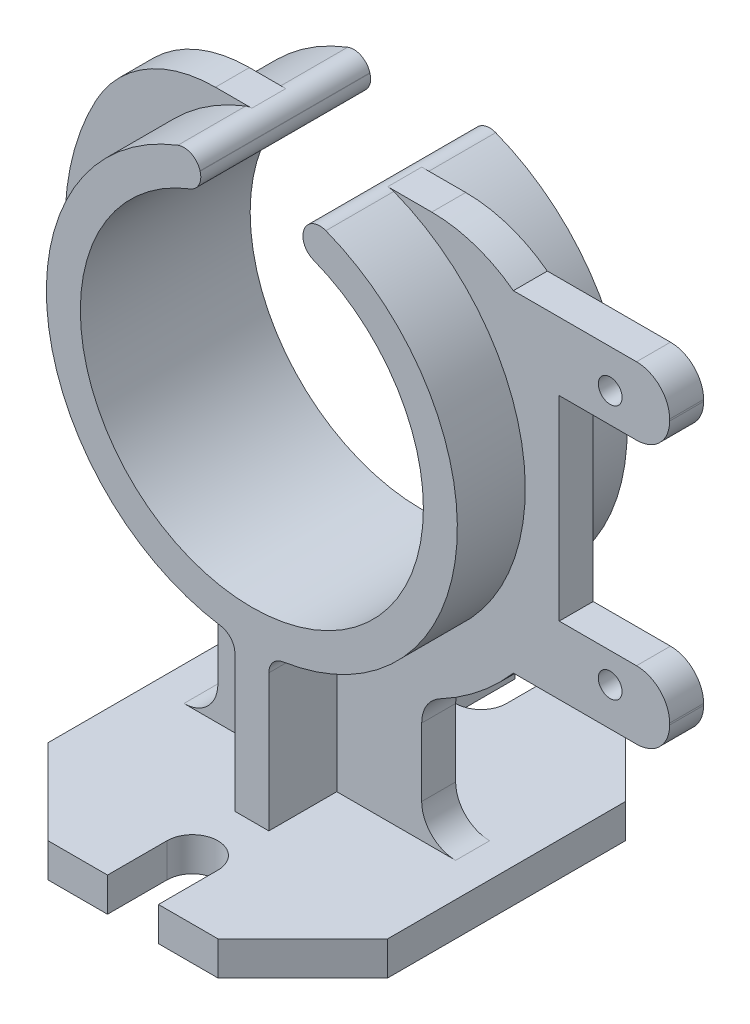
SolidWorks part; units mm, degrees
ref_plane "Plan de face" through (0, 0, 0) normal (0, 0, 1) x (1, 0, 0)
ref_plane "Plan de dessus" through (0, 0, 0) normal (0, 1, 0) x (1, 0, 0)
ref_plane "Plan de droite" through (0, 0, 0) normal (1, 0, 0) x (0, 0, -1)
sketch "Esquisse1" plane through (0, 0, 0) normal (0, 0, 1) x (1, 0, 0)
  line L0 (-30.0885, 0) -> (50.7908, 0) construction
  line L1 (-25.3516, 23) -> (39.2116, 23) construction
  line L2 (0, -16.5794) -> (0, 50.6154) construction
  line L3 (-3.0446, 33.6178) -> (-3.0501, 33.6371)
  line L4 (3.0446, 33.6178) -> (3.0501, 33.6371)
  line L5 (-1, -6.4037) -> (-1, 17.4566) construction
  line L6 (1, 15.0004) -> (1, -2.5439) construction
  line L7 (-1, 10.0621) -> (-1, 0)
  line L8 (-1, 0) -> (1, 0)
  line L9 (1, 0) -> (1, 10.0621)
  arc A0 (-3.6395, 32.4215) -> (3.6395, 32.4215) centre (0, 23) ccw
  arc A1 (-4.3584, 34.2878) -> (-1.8395, 11.0406) centre (0, 23) ccw
  arc A2 (1.8395, 11.0406) -> (4.3584, 34.2878) centre (0, 23) ccw
  arc A3 (3.0446, 33.6178) -> (3.6395, 32.4215) centre (3.9963, 33.3449) ccw
  arc A4 (3.0501, 33.6371) -> (4.3584, 34.2878) centre (4.0018, 33.3643) cw
  arc A5 (-3.6395, 32.4215) -> (-3.0446, 33.6178) centre (-3.9963, 33.3449) ccw
  arc A6 (-4.3584, 34.2878) -> (-3.0501, 33.6371) centre (-4.0018, 33.3643) cw
  arc A7 (1.8395, 11.0406) -> (1, 10.0621) centre (1.99, 10.0621) ccw
  arc A8 (-1.8395, 11.0406) -> (-1, 10.0621) centre (-1.99, 10.0621) cw
  point P30 (1, 10.9414)
  point P33 (-1, 10.9414)
  dimension "D1" = 16
  dimension "D2" = 0.99
  dimension "D3" = 0.99
extrude "Extrusion1" add sketch "Esquisse1" along normal mid plane 10
sketch "Esquisse2" plane through (0, 0, 0) normal (0, -1, 0) x (1, 0, 0)
  line L0 (0, 14.2709) -> (0, -17.2389) construction
  line L1 (-20.7015, 0) -> (25.7965, 0) construction
  line L2 (-6.4553, 8.5) -> (6.4553, 8.5) construction
  line L3 (-16.7442, 12) -> (19.7122, 12) construction
  line L4 (10, -4.3777) -> (10, 16.9915) construction
  line L6 (-10, -2.7134) -> (-10, 14.2709) construction
  line L8 (-10, -12) -> (-10, 12)
  line L9 (-10, 12) -> (-1.5, 12)
  line L10 (10, 12) -> (10, -12)
  line L11 (-10, -12) -> (-1.5, -12)
  line L12 (-1.5, 14.979) -> (-1.5, -16.4639) construction
  line L13 (1.5, 14.979) -> (1.5, -16.4639) construction
  line L14 (1.5, 12) -> (10, 12)
  line L15 (1.5, -12) -> (10, -12)
  line L16 (1.5, 8.5) -> (1.5, 12)
  line L17 (-1.5, 12) -> (-1.5, 8.5)
  line L18 (-1.5, -12) -> (-1.5, -8.5)
  line L19 (1.5, -8.5) -> (1.5, -12)
  circle A0 centre (0, 8.5) radius 3 construction
  arc A1 (-1.5, 8.5) -> (1.5, 8.5) centre (0, 8.5) ccw
  arc A2 (-1.5, -8.5) -> (1.5, -8.5) centre (0, -8.5) cw
  point P21 (-10, 0)
  point P22 (10, 0)
extrude "Extrusion2" add sketch "Esquisse2" against normal blind 2
sketch "Esquisse3" plane through (0, 0, 0) normal (0, 0, 1) x (1, 0, 0)
  line L0 (4.0018, 34.3543) -> (5.3054, 32.75)
  line L1 (0, 40.2367) -> (0, -11.4864) construction
  line L2 (-9.8021, 34.3543) -> (-4.0018, 34.3543)
  line L3 (-6, 11.3081) -> (-6, -4.2164) construction
  line L4 (-12.4575, 1) -> (13.5934, 1) construction
  line L5 (6, 11.3081) -> (6, -1.8688) construction
  line L6 (6, 9.2523) -> (6, 1)
  line L7 (6, 1) -> (-6, 1)
  line L8 (-6, 1) -> (-6, 9.2523)
  line L9 (-12.2737, 34.3543) -> (10.1642, 34.3543) construction
  line L10 (-4.0018, 34.3543) -> (-5.3054, 32.75)
  line L11 (9.8021, 34.3543) -> (4.0018, 34.3543)
  line L12 (21.067, 23) -> (-23.9945, 23) construction
  line L13 (14.1, 35) -> (14.1, 8.0763) construction
  line L14 (21.067, 28.75) -> (12.882, 28.75) construction
  line L15 (20.6, 36) -> (20.6, 8.0763) construction
  line L16 (22.3451, 32.75) -> (10, 32.75) construction
  line L17 (11.399, 32.75) -> (18.65, 32.75)
  line L18 (20.6, 30.8) -> (20.6, 30.7)
  line L19 (18.65, 28.75) -> (14.1, 28.75)
  line L20 (18.65, 17.25) -> (14.1, 17.25)
  line L21 (11.399, 13.25) -> (18.65, 13.25)
  line L22 (20.6, 15.2) -> (20.6, 15.3)
  line L23 (14.1, 28.75) -> (14.1, 17.25)
  circle A0 centre (17.1, 30.5) radius 0.7
  arc A1 (-9.8021, 34.3543) -> (-6, 9.2523) centre (0, 23) ccw
  arc A2 (-5.3054, 32.75) -> (5.3054, 32.75) centre (0, 23) ccw
  arc A3 (6, 9.2523) -> (11.399, 13.25) centre (0, 23) ccw
  arc A4 (-3.0501, 33.6371) -> (-4.3584, 34.2878) centre (-4.0018, 33.3643) ccw construction
  arc A5 (18.65, 32.75) -> (20.6, 30.8) centre (18.65, 30.8) cw
  arc A6 (20.6, 30.7) -> (18.65, 28.75) centre (18.65, 30.7) cw
  circle A7 centre (17.1, 15.5) radius 0.7
  arc A8 (18.65, 13.25) -> (20.6, 15.2) centre (18.65, 15.2) ccw
  arc A9 (20.6, 15.3) -> (18.65, 17.25) centre (18.65, 15.3) ccw
  arc A11 (11.399, 32.75) -> (9.8021, 34.3543) centre (0, 23) ccw
  dimension "D1" = 1.95
extrude "Extrusion3" add sketch "Esquisse3" along normal mid plane 2
fillet "Congé1" radius 8 2 edges at (-9.8021, 34.3543, 0) (9.8021, 34.3543, 0)
fillet "Congé2" radius 2 2 edges at (6, 2, 0) (-6, 2, 0)
chamfer "Chanfrein1" distance 5 angle 45 4 edges at (10, 1, 12) (10, 1, -12) (-10, 1, -12) (-10, 1, 12)
fillet "Congé4" radius 2 2 edges at (6, 9.2523, 0) (-6, 9.2523, 0)
